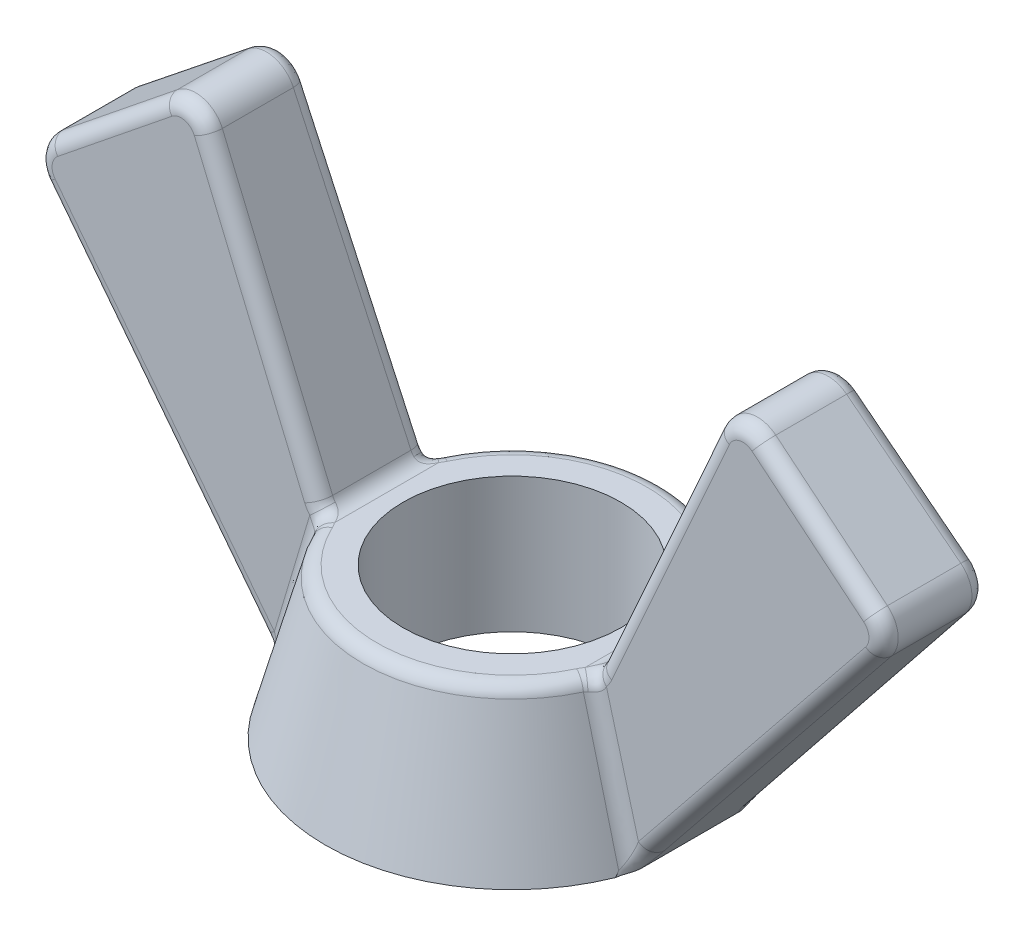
SolidWorks part; units mm, degrees
ref_plane "Front Plane" through (0, 0, 0) normal (0, 0, 1) x (1, 0, 0)
ref_plane "Top Plane" through (0, 0, 0) normal (0, 1, 0) x (1, 0, 0)
ref_plane "Right Plane" through (0, 0, 0) normal (1, 0, 0) x (0, 0, -1)
sketch "BaseNutSke" plane through (0, 0, 0) normal (0, 0, 1) x (1, 0, 0)
  line L0 (0, 0) -> (-15, 0)
  line L1 (-15, 0) -> (-11.75, 12)
  line L2 (-11.75, 12) -> (0, 12)
  line L3 (0, 12) -> (0, 0)
  line L4 (0, -38.5148) -> (0, 38.5148) construction
  dimension "Top_Width" = 23.5
  dimension "Bottom_Width" = 30
  dimension "Nut_Height" = 12
revolve "BaseNut" add sketch "BaseNutSke" angle 360 about L4
sketch "BaseWingSke" plane through (0, 0, 0) normal (1, 0, 0) x (0, 0, -1)
  line L0 (0, 0) -> (0, 62.8635) construction
  line L1 (-4, 35) -> (-4.5, 0)
  line L2 (-4, 35) -> (4, 35)
  line L3 (4, 35) -> (4.5, 0)
  line L4 (4.5, 0) -> (-4.5, 0)
  point P8 (0, 35)
  dimension "TopWing_Width" = 8
  dimension "BottomWing_Width" = 9
  dimension "Height" = 35
extrude "BaseWing" add sketch "BaseWingSke" along normal mid plane 68
sketch "CutWingSke" plane through (0, 0, 0) normal (0, 0, 1) x (1, 0, 0)
  line L0 (0, 0) -> (0, 84.5075) construction
  line L1 (-14.3091, 0) -> (-33.4829, 23.8969)
  line L2 (-10.9236, 12) -> (-20.4226, 33.5962)
  line L3 (34, 35) -> (-34, 35) construction
  line L4 (-34, 35) -> (-34, 0) construction
  line L5 (-24.0444, 34.4829) -> (-33.1207, 27.2005)
  line L6 (14.3091, 0) -> (33.4829, 23.8969)
  line L7 (24.0444, 34.4829) -> (33.1207, 27.2005)
  line L8 (10.9236, 12) -> (20.4226, 33.5962)
  line L9 (-14.3091, 0) -> (-34, 0) construction
  line L10 (-44, 45) -> (44, 45)
  line L11 (-44, 45) -> (-44, -10)
  line L12 (-44, -10) -> (44, -10)
  line L13 (44, 45) -> (44, -10)
  line L14 (34, 35) -> (34, 0) construction
  line L15 (-10.9236, 12) -> (10.9236, 12)
  line L16 (14.3091, 0) -> (-14.3091, 0)
  arc A0 (-20.4226, 33.5962) -> (-24.0444, 34.4829) centre (-22.5737, 32.65) ccw
  arc A1 (-33.4829, 23.8969) -> (-33.1207, 27.2005) centre (-31.65, 25.3676) cw
  arc A2 (33.4829, 23.8969) -> (33.1207, 27.2005) centre (31.65, 25.3676) ccw
  arc A3 (20.4226, 33.5962) -> (24.0444, 34.4829) centre (22.5737, 32.65) cw
  dimension "D5" = 2.35
  dimension "D1" = 10
  dimension "Wing_ang" = 15
  dimension "D2" = 10
  dimension "D3" = 10
  dimension "D4" = 10
extrude "CutWing" cut sketch "CutWingSke" against normal mid plane 68
sketch "HoleSke" plane through (0, 0, 0) normal (0, 1, 0) x (1, 0, 0)
  circle A0 centre (0, 0) radius 8.75
  dimension "Tap_drill" = 17.5
extrude "TappedHole" cut sketch "HoleSke" along normal through all
chamfer "Chamfer1" distance 1.1667 angle 60 1 edges at (0, 0, 8.75)
sketch "ThdSchSke" plane through (0, 0, 0) normal (0, 0, 1) x (1, 0, 0)
  line L0 (8.75, 1.1667) -> (7.3066, 1.1667)
  line L1 (7.3066, 1.1667) -> (7.3066, 2.61)
  line L2 (7.3066, 2.61) -> (8.75, 2.61)
  line L3 (8.75, 2.61) -> (10, 1.8884)
  line L4 (10, 1.8884) -> (8.75, 1.1667)
  line L5 (0, -3.4614) -> (0, 8.4929) construction
  line L6 (-8.75, 1.1667) -> (8.75, 1.1667) construction
  dimension "D1" = 17.5
  dimension "ThreadN" = 20
revolve "ThreadSchematic" [suppressed] cut sketch "ThdSchSke" angle 360 about L5
pattern_linear "ThdSchPat" [suppressed]
fillet "Fillet1" radius 1.3056 6 edges at (10.9236, 12, 0) (-10.9236, 12, 0)
fillet "Fillet2" radius 1.175 38 edges at (-14.6132, 0.3791, 4.6115) (-24.2551, 12.396, 4.3229) (-15.9429, 23.4115, 4.1655) (-33.986, 25.6237, 4.1339) (-33.986, 25.6237, -4.1339) (-14.6196, 0.387, -4.6077) (-24.2551, 12.396, -4.3229) (-15.9429, 23.4115, -4.1655) (14.6132, 0.3791, -4.6115) (24.2551, 12.396, -4.3229) (33.986, 25.6237, -4.1339) (28.5825, 30.8417, -4.0594) (22.0148, 34.9326, -4.001) (-28.5825, 30.8417, -4.0594) (-22.0148, 34.9326, -4.001) (-10.8692, 12.2719, -4.6314) (0, 12, 11.75) (0, 12, -11.75) (10.9957, 12.3833, -4.5188) (-28.5825, 30.8417, 4.0594) (-22.0148, 34.9326, 4.001) (14.6196, 0.387, 4.6077) (24.2551, 12.396, 4.3229) (33.986, 25.6237, 4.1339) (28.5825, 30.8417, 4.0594) (22.0148, 34.9326, 4.001) (15.9429, 23.4115, 4.1655) (10.8692, 12.2719, 4.6314) (-10.9957, 12.3833, 4.5188) (15.9429, 23.4115, -4.1655)
equation "\"D1@CutWing\" = \"Width@BaseWing\""
equation "\"D5@CutWingSke\" = \"Top_Width@BaseNutSke\"/10"
equation "\"D1@Chamfer1\" = \"Tap_drill@HoleSke\"/15"
equation "\"D1@ThdSchSke\" = \"Tap_drill@HoleSke\""
equation "\"ThreadN@ThdSchSke\" = \"Thread_major@ThreadCosmetic\""
equation "\"Num_threads@ThdSchPat\" = int( \"Nut_Height@BaseNutSke\"/\"Advance@ThdSchPat\" ) +1"
equation "\"D1@Fillet1\" =\"Top_Width@BaseNutSke\"/18"
equation "\"D1@Fillet2\" = \"Top_Width@BaseNutSke\"/20"
